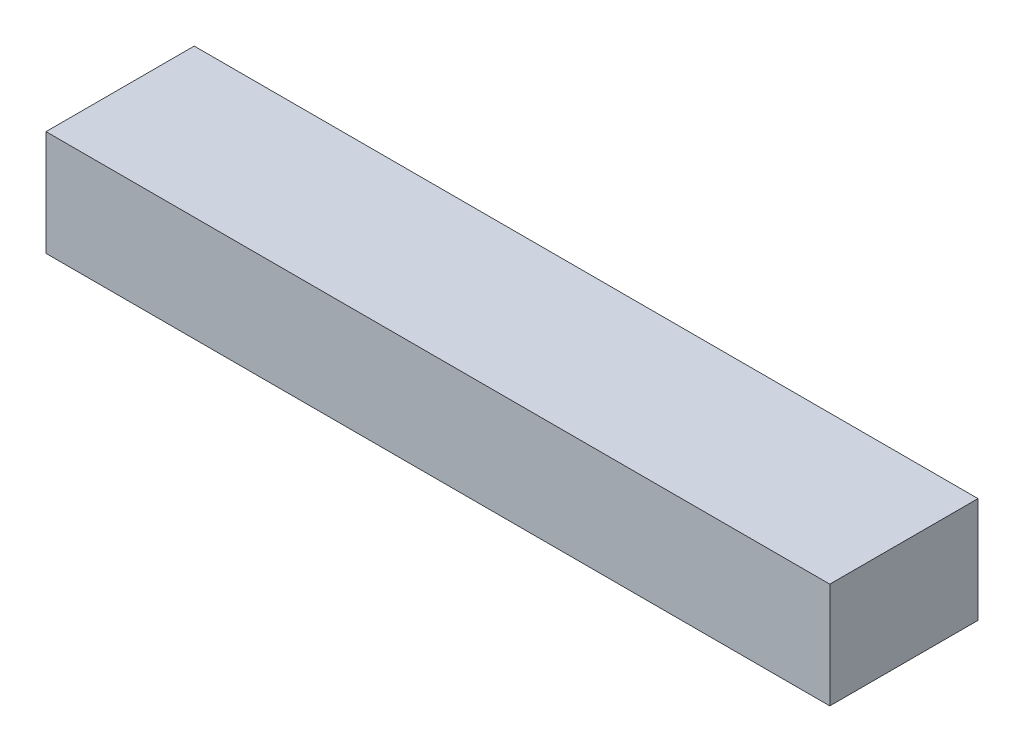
SolidWorks part; units mm, degrees
ref_plane "Plan de face" through (0, 0, 0) normal (0, 0, 1) x (1, 0, 0)
ref_plane "Plan de dessus" through (0, 0, 0) normal (0, 1, 0) x (1, 0, 0)
ref_plane "Plan de droite" through (0, 0, 0) normal (1, 0, 0) x (0, 0, -1)
sketch "Esquisse1" plane through (0, 0, 0) normal (0, 0, 1) x (1, 0, 0)
  line L1 (185.1073, -24.9115) -> (-185.1073, -24.9115)
  line L2 (185.1073, -24.9115) -> (185.1073, 24.9115)
  line L3 (185.1073, 24.9115) -> (-185.1073, 24.9115)
  line L4 (-185.1073, -24.9115) -> (-185.1073, 24.9115)
  line L5 (185.1073, -24.9115) -> (-185.1073, 24.9115) construction
  line L6 (185.1073, 24.9115) -> (-185.1073, -24.9115) construction
  point P0 (0, 0)
extrude "Boss.-Extru.1" add sketch "Esquisse1" along normal mid plane 70
